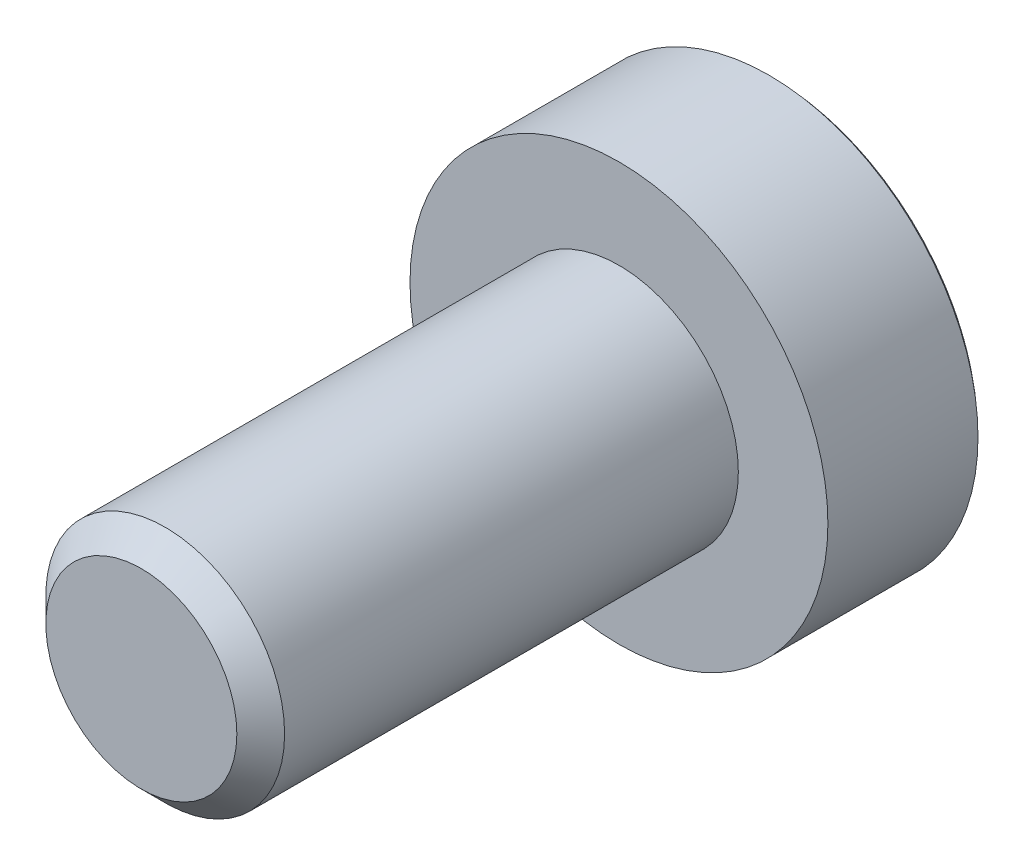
SolidWorks part; units mm, degrees
ref_plane "Plane1" through (0, 0, 0) normal (0, 0, 1) x (1, 0, 0)
ref_plane "Plane2" through (0, 0, 0) normal (0, 1, 0) x (1, 0, 0)
ref_plane "Plane3" through (0, 0, 0) normal (1, 0, 0) x (0, 0, -1)
sketch "Sketch1" plane through (0, 0, 0) normal (0, 0, 1) x (1, 0, 0)
  circle A0 centre (0, 0) radius 1.9
  dimension "D1" = 3.8
extrude "Base-Extrude" add sketch "Sketch1" along normal blind 1.4
sketch "Sketch2" plane through (0, 0, 1.4) normal (0, 0, 1) x (1, 0, 0)
  circle A0 centre (0, 0) radius 1
  dimension "D1" = 2
extrude "Boss-Extrude1" add sketch "Sketch2" along normal blind 4
chamfer "Chamfer1" distance 0.2 angle 45 1 edges at (1, 0, 5.4)
chamfer "Chamfer2" distance 0.1 angle 45 1 edges at (1.9, 0, 1.4)
fillet "Fillet1" radius 0.5 1 edges at (1.9, 0, 0)
sketch "Sketch3" plane through (0, 0, 0) normal (0, 0, -1) x (-1, 0, 0)
  line L2 (-0.3, 1.2886) -> (-0.3, 0.2924)
  line L4 (0.3, 1.2886) -> (0.3, 0.2924)
  line L5 (1.2903, 0.2924) -> (0.3, 0.2924)
  line L7 (1.2886, -0.3) -> (0.3, -0.3)
  line L8 (0.3, -0.3) -> (0.3, -1.2886)
  line L9 (-0.3, -0.3) -> (-1.2886, -0.3)
  line L10 (-0.3, -0.3) -> (-0.3, -1.2886)
  line L11 (-0.3, 0.2924) -> (-1.2903, 0.2924)
  arc A1 (-1.2903, 0.2924) -> (-1.2886, -0.3) centre (0, 0) ccw
  arc A2 (0.3, 1.2886) -> (-0.3, 1.2886) centre (0, 0) ccw
  arc A3 (1.2886, -0.3) -> (1.2903, 0.2924) centre (0, 0) ccw
  arc A4 (-0.3, -1.2886) -> (0.3, -1.2886) centre (0, 0) ccw
extrude "Cut-Extrude1" cut sketch "Sketch3" against normal blind 0.5 draft 10
sketch "Sketch4" plane through (0, 0, 0) normal (0, 0, -1) x (-1, 0, 0)
  circle A0 centre (0, 0) radius 1.75
  dimension "D1" = 3.5
extrude "Extrude1" cut sketch "Sketch4" against normal blind 6 flip side to cut
